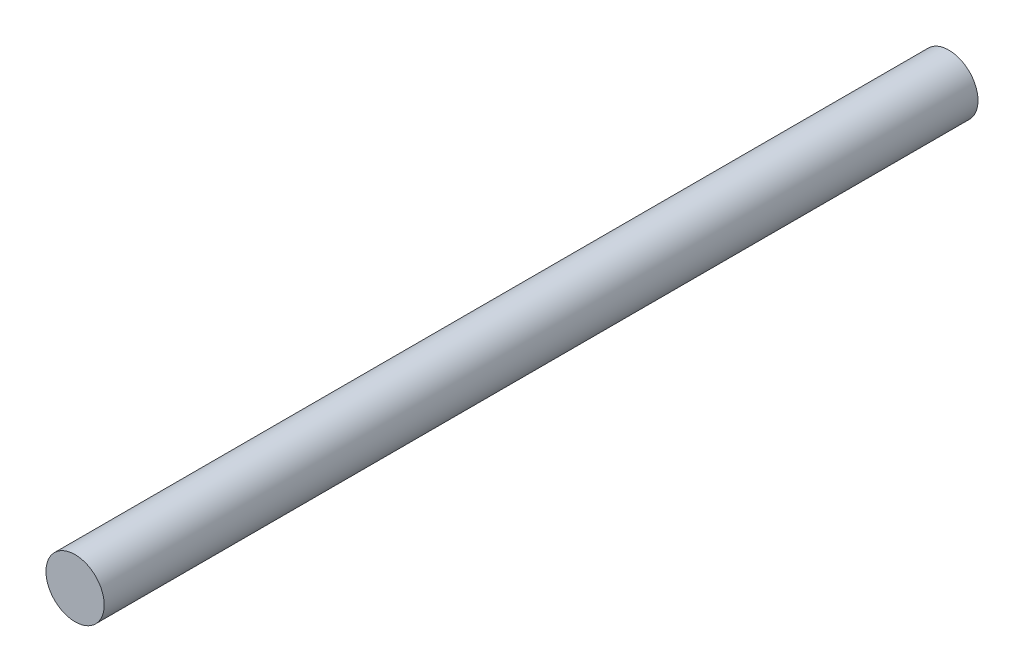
SolidWorks part; units mm, degrees
ref_plane "Front Plane" through (0, 0, 0) normal (0, 0, 1) x (1, 0, 0)
ref_plane "Top Plane" through (0, 0, 0) normal (0, 1, 0) x (1, 0, 0)
ref_plane "Right Plane" through (0, 0, 0) normal (1, 0, 0) x (0, 0, -1)
sketch "Sketch1" plane through (0, 0, 0) normal (0, 0, 1) x (1, 0, 0)
  circle A0 centre (0, 0) radius 30
  dimension "D1" = 60
extrude "Boss-Extrude1" add sketch "Sketch1" against normal blind 900
